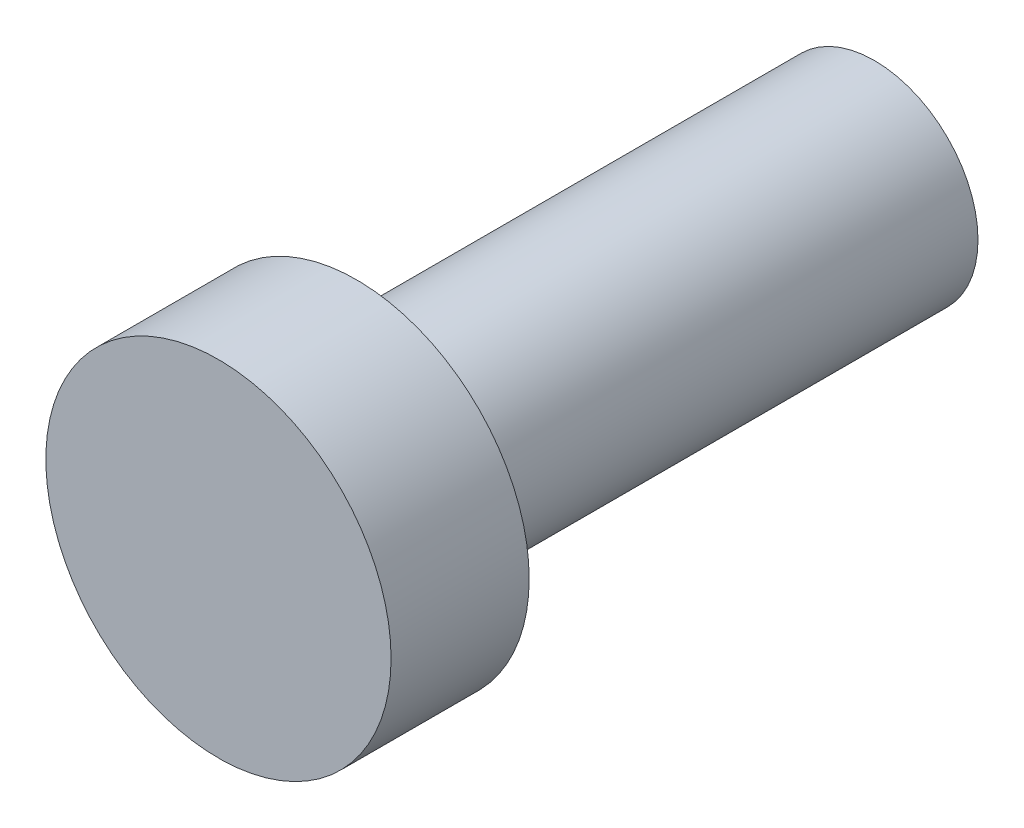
SolidWorks part; units mm, degrees
ref_plane "前视基准面" through (0, 0, 0) normal (0, 0, 1) x (1, 0, 0)
ref_plane "上视基准面" through (0, 0, 0) normal (0, 1, 0) x (1, 0, 0)
ref_plane "右视基准面" through (0, 0, 0) normal (1, 0, 0) x (0, 0, -1)
sketch "草图1" plane through (0, 0, 0) normal (0, 0, 1) x (1, 0, 0)
  circle A1 centre (0, 0) radius 5
  dimension "D1" = 10
extrude "拉伸1" add sketch "草图1" along normal blind 4
sketch "草图2" plane through (0, 0, 0) normal (0, 0, 1) x (1, 0, 0)
  circle A0 centre (0, 0) radius 3
  dimension "D1" = 6
extrude "拉伸2" add sketch "草图2" against normal blind 15
